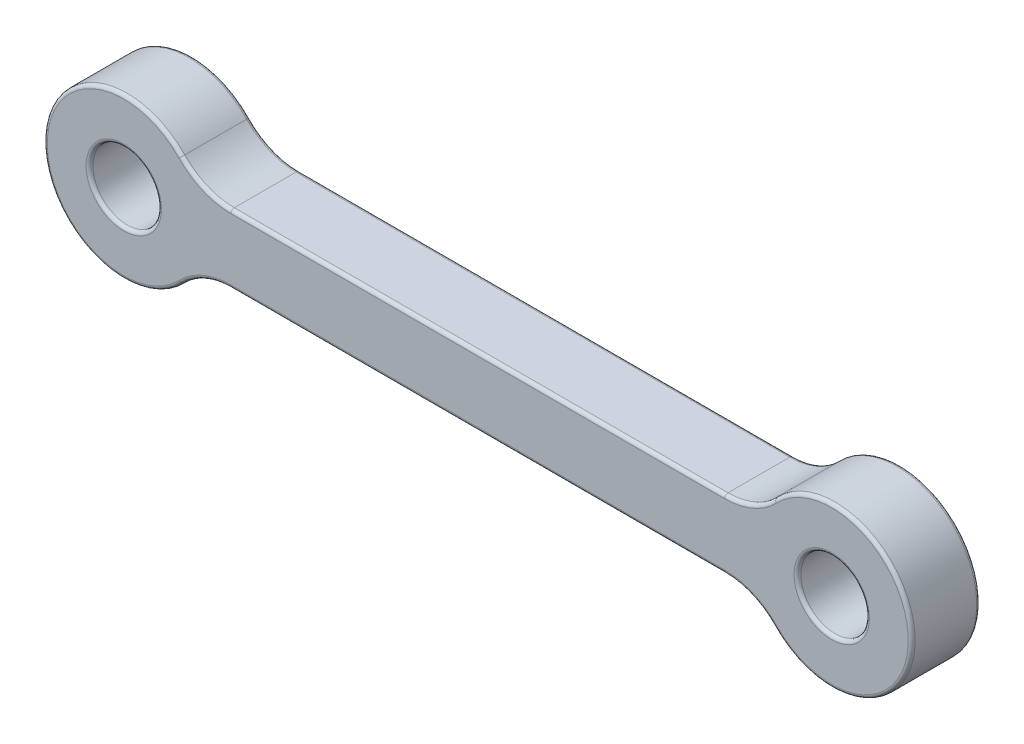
SolidWorks part; units mm, degrees
ref_plane "Front Plane" through (0, 0, 0) normal (0, 0, 1) x (1, 0, 0)
ref_plane "Top Plane" through (0, 0, 0) normal (0, 1, 0) x (1, 0, 0)
ref_plane "Right Plane" through (0, 0, 0) normal (1, 0, 0) x (0, 0, -1)
sketch "Sketch1" plane through (0, 0, 0) normal (0, 0, 1) x (1, 0, 0)
  line L0 (1.5, 0) -> (15.5, 0) construction
  line L1 (0, 3.5) -> (31, 3.5) construction
  line L2 (0, -3.5) -> (31, -3.5) construction
  line L3 (15.5, 0) -> (15.5, -3.5) construction
  line L4 (15.5, 0) -> (0, -1.5) construction
  line L5 (27.8377, -1.5) -> (3.1623, -1.5)
  line L7 (27.8377, 1.5) -> (3.1623, 1.5)
  line L9 (31, -1.5) -> (30.7124, -1.4722) construction
  line L10 (31, 1.5) -> (30.7124, 1.4722) construction
  line L11 (29.5, 0) -> (31, 0) construction
  line L12 (15.5, 0) -> (0, 1.5) construction
  arc A0 (0, 3.5) -> (0, -3.5) centre (0, 0) ccw construction
  arc A1 (31, -3.5) -> (31, 3.5) centre (31, 0) ccw construction
  circle A2 centre (0, 0) radius 1.5
  circle A3 centre (31, 0) radius 1.5
  arc A4 (3.1623, 1.5) -> (3.1623, -1.5) centre (0, 0) ccw
  arc A5 (27.8377, -1.5) -> (27.8377, 1.5) centre (31, 0) ccw
  point P3 (15.5, 0)
  dimension "D3" = 3
  dimension "D1" = 31
  dimension "D2" = 7
  dimension "D4" = 3
extrude "Boss-Extrude1" add sketch "Sketch1" along normal mid plane 3
fillet "Fillet1" radius 3 4 edges at (27.8377, -1.5, 0) (27.8377, 1.5, 0) (3.1623, -1.5, 0) (3.1623, 1.5, 0)
fillet "Fillet2" radius 0.15 20 edges at (29.5, 0, 1.5) (3.5137, -1.7404, 1.5) (-3.5, 0, 1.5) (3.5137, 1.7404, 1.5) (15.5, 1.5, 1.5) (27.4863, 1.7404, 1.5) (34.5, 0, 1.5) (27.4863, -1.7404, 1.5) (15.5, -1.5, 1.5) (1.5, 0, 1.5) (29.5, 0, -1.5) (1.5, 0, -1.5) (27.4863, 1.7404, -1.5) (15.5, 1.5, -1.5) (3.5137, 1.7404, -1.5) (-3.5, 0, -1.5) (3.5137, -1.7404, -1.5) (15.5, -1.5, -1.5) (27.4863, -1.7404, -1.5) (34.5, 0, -1.5)
